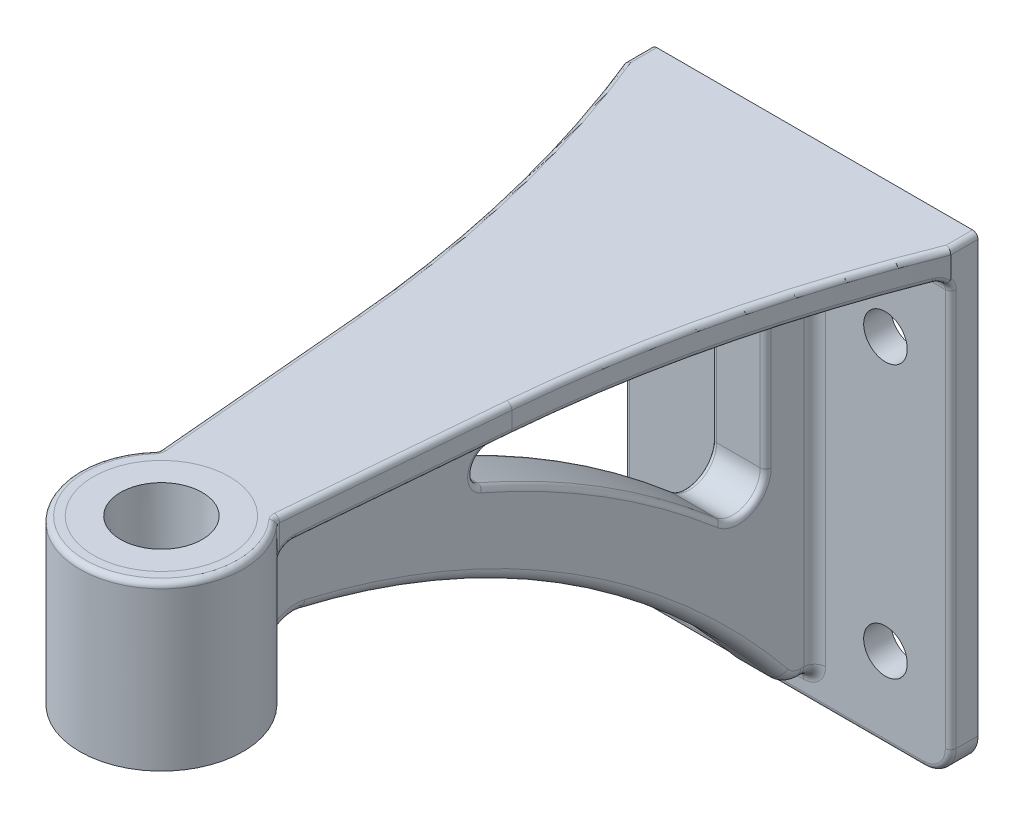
SolidWorks part; units mm, degrees
ref_plane "Front Plane" through (0, 0, 0) normal (0, 0, 1) x (1, 0, 0)
ref_plane "Top Plane" through (0, 0, 0) normal (0, 1, 0) x (1, 0, 0)
ref_plane "Right Plane" through (0, 0, 0) normal (1, 0, 0) x (0, 0, -1)
sketch "Sketch2" plane through (0, 0, 0) normal (0, 0, 1) x (1, 0, 0)
  line L1 (0, 0) -> (38.1, 0)
  line L2 (0, 0) -> (0, -107.95)
  line L3 (0, -107.95) -> (38.1, -107.95)
  line L4 (38.1, 0) -> (38.1, -107.95)
  dimension "D1" = 107.95
  dimension "D2" = 38.1
sketch "Sketch3" plane through (0, 0, 0) normal (1, 0, 0) x (0, 0, -1)
  line L0 (0, 0) -> (0, -101.6)
  line L1 (0, 0) -> (0, -107.95) construction
  line L2 (0, 0) -> (0, -107.95) construction
  line L3 (0, -101.6) -> (-12.7, -101.6)
  line L4 (0, 0) -> (-152.4, 0)
  line L5 (-152.4, 0) -> (-152.4, -25.4)
  arc A0 (-152.4, -25.4) -> (-12.7, -101.6) centre (-172.0833, -227.6444) cw
  dimension "D4" = 203.2
  dimension "D1" = 25.4
  dimension "D2" = 12.7
  dimension "D3" = 152.4
  dimension "D5" = 101.6
extrude "Boss-Extrude2" add sketch "Sketch3" along normal blind 6.35
extrude "Boss-Extrude3" add sketch "Sketch2" along normal blind 6.35
sketch "Sketch4" plane through (0, 0, 0) normal (0, 1, 0) x (1, 0, 0)
  line L0 (0, 0) -> (38.1, 0)
  line L1 (38.1, 0) -> (38.1, -6.35)
  line L2 (0, 0) -> (0, -152.4)
  line L3 (0, -152.4) -> (12.7, -152.4)
  line L4 (12.7, -152.4) -> (18.2555, -88.9)
  line L5 (18.2555, -88.9) -> (6.35, -88.9) construction
  line L6 (6.35, -6.35) -> (6.35, -152.4) construction
  arc A0 (18.2555, -88.9) -> (38.1, -6.35) centre (303.7945, -113.8814) cw
  dimension "D1" = 12.7
  dimension "D2" = 63.5
  dimension "D3" = 5
extrude "Boss-Extrude4" add sketch "Sketch4" against normal blind 6.35
sketch "Sketch5" plane through (0, 0, 6.35) normal (0, 0, 1) x (1, 0, 0)
  line L0 (22.86, -25.4) -> (22.86, -88.9) construction
  line L1 (0, -107.95) -> (38.1, -107.95) construction
  line L2 (6.35, -6.35) -> (38.1, -6.35) construction
  line L3 (38.1, -107.95) -> (38.1, -6.35) construction
  circle A0 centre (22.86, -25.4) radius 5.08
  circle A1 centre (22.86, -88.9) radius 5.08
  dimension "D4" = 10.16
  dimension "D1" = 19.05
  dimension "D2" = 19.05
  dimension "D3" = 15.24
extrude "Cut-Extrude1" cut sketch "Sketch5" against normal up to next
mirror "Mirror1" about plane through (0, -227.6444, 172.0833) normal (-1, 0, 0)
sketch "Sketch6" plane through (0, 0, 0) normal (0, 1, 0) x (1, 0, 0)
  line L0 (12.7, -152.4) -> (-12.7, -152.4) construction
  circle A0 centre (0, -152.4) radius 19.05
  dimension "D1" = 38.1
extrude "Boss-Extrude5" add sketch "Sketch6" against normal blind 38.1
sketch "Sketch7" plane through (0, 0, 0) normal (0, 1, 0) x (1, 0, 0)
  circle A0 centre (0, -152.4) radius 9.525
  dimension "D1" = 19.05
extrude "Cut-Extrude2" cut sketch "Sketch7" against normal up to next draft 3
fillet "Fillet1" radius 6.35 4 edges at (1.9825, -28.1501, 133.4534) (0, -101.6, 12.7) (38.1, -107.95, 3.175) (-38.1, -107.95, 3.175)
fillet "Fillet2" radius 2.54 19 edges at (6.35, -30.5702, 131.6146) (6.35, -101.6, 8.0026) (6.35, -100.9858, 12.3797) (22.225, -6.35, 6.35) (6.35, -6.35, 70.3947) (6.35, -21.0203, 134.4395) (6.35, -55.1477, 64.6817) (6.35, -53.975, 6.35) (-6.35, -53.975, 6.35) (-6.35, -101.6, 8.0026) (-6.35, -31.4852, 132.7233) (-6.35, -55.1477, 64.6817) (10.3875, -6.35, 136.4312) (-10.3875, -6.35, 136.4312) (-6.35, -21.0203, 134.4395) (-6.35, -6.35, 70.3947) (-22.225, -6.35, 6.35) (-6.35, -100.9858, 12.3797) (0, -101.6, 6.35)
fillet "Fillet3" radius 1.27 22 edges at (-25.1043, 0, 46.8862) (-16.0502, 0, 114.1074) (0, 0, 171.45) (16.0502, 0, 114.1074) (-38.1, 0, 3.175) (-13.8448, -4.445, 139.3148) (13.8448, -4.445, 139.3148) (38.1, 0, 3.175) (25.1043, 0, 46.8862) (13.8865, -7.5867, 138.8387) (16.1919, -6.35, 112.4873) (37.7541, -6.9862, 7.2086) (-13.9179, -7.2099, 138.479) (38.1, -55.245, 6.35) (36.2401, -106.0901, 6.35) (0, -107.95, 6.35) (-36.2401, -106.0901, 6.35) (-38.1, -55.245, 6.35) (-37.902, -7.3895, 6.8406) (-24.7879, -6.35, 48.2165) (24.7879, -6.35, 48.2165) (-16.1919, -6.35, 112.4873)
sketch "Sketch9" plane through (6.35, 0, 0) normal (1, 0, 0) x (0, 0, -1)
  line L8 (-17.78, -69.4589) -> (-17.78, -17.78)
  line L9 (-17.78, -17.78) -> (-102.8801, -17.78)
  line L10 (-17.78, -69.4589) -> (-17.78, -17.78)
  line L11 (-17.78, -17.78) -> (-102.8801, -17.78)
  arc A2 (-17.78, -69.4589) -> (-102.8801, -17.78) centre (-172.0833, -227.6444) ccw
  arc A3 (-17.78, -69.4589) -> (-102.8801, -17.78) centre (-172.0833, -227.6444) ccw
  dimension "D1" = 17.78
extrude "Cut-Extrude3" cut sketch "Sketch9" against normal through all
fillet "Fillet6" radius 6.35 1 edges at (0, -69.4589, 17.78)
fillet "Fillet4" radius 3.81 2 edges at (0, -17.78, 102.8801) (0, -17.78, 17.78)
fillet "Fillet5" radius 1.27 12 edges at (-6.35, -18.8959, 18.8959) (-6.35, -38.3201, 17.78) (-6.35, -40.4092, 54.7158) (-6.35, -20.8122, 85.9681) (6.35, -18.8959, 18.8959) (6.35, -38.3201, 17.78) (6.35, -40.4092, 54.7158) (6.35, -20.8122, 85.9681) (-6.35, -17.78, 51.9142) (6.35, -17.78, 51.9142) (-6.35, -60.8194, 21.4768) (6.35, -60.8194, 21.4768)
sketch "Sketch13" plane through (0, 0, 0) normal (0, 1, 0) x (1, 0, 0)
  circle A0 centre (0, -152.4) radius 15.875
  dimension "D1" = 31.75
